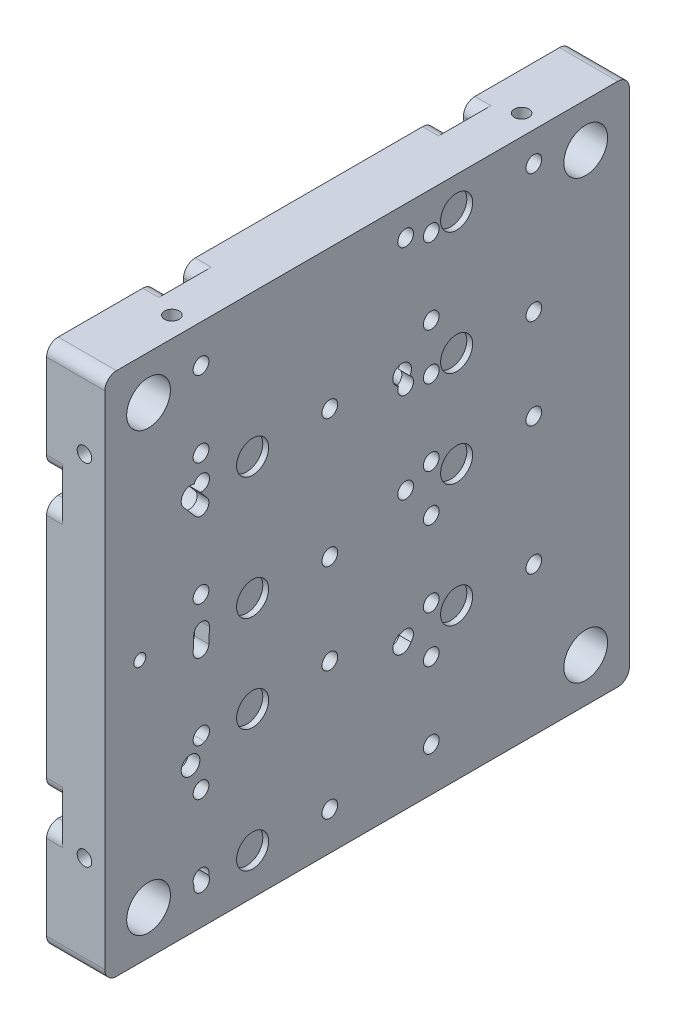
SolidWorks part; units mm, degrees
ref_plane "前视基准面" through (0, 0, 0) normal (0, 0, 1) x (1, 0, 0)
ref_plane "上视基准面" through (0, 0, 0) normal (0, 1, 0) x (1, 0, 0)
ref_plane "右视基准面" through (0, 0, 0) normal (1, 0, 0) x (0, 0, -1)
sketch "草图1" plane through (0, 0, 0) normal (1, 0, 0) x (0, 0, -1)
  line L1 (-45, 45) -> (45, 45)
  line L2 (-45, 45) -> (-45, -45)
  line L3 (-45, -45) -> (45, -45)
  line L4 (45, 45) -> (45, -45)
  line L5 (-45, 45) -> (45, -45) construction
  line L6 (-45, -45) -> (45, 45) construction
  point P0 (0, 0)
  dimension "D1" = 90
  dimension "D2" = 90
extrude "凸台-拉伸1" add sketch "草图1" along normal blind 10
sketch "草图2" plane through (0, 0, 0) normal (-1, 0, 0) x (0, 0, 1)
  line L0 (-25, -25) -> (-25, 25) construction
  line L1 (-26.5, -26.5) -> (26.5, -26.5)
  line L2 (-26.5, -26.5) -> (-26.5, 26.5)
  line L3 (-21.5, 26.5) -> (21.5, 26.5)
  line L4 (26.5, -21.5) -> (26.5, 21.5)
  line L5 (25, -25) -> (-25, -25) construction
  line L6 (-25, 25) -> (25, 25) construction
  line L7 (25, 25) -> (25, -25) construction
  line L8 (45, 45) -> (45, -45) construction
  line L9 (26.5, -26.5) -> (45, -26.5)
  line L10 (-45, 45) -> (45, 45) construction
  line L11 (26.5, -21.5) -> (45, -21.5)
  line L12 (45, -26.5) -> (45, -21.5)
  line L14 (26.5, 26.5) -> (45, 26.5)
  line L15 (-26.5, 26.5) -> (-26.5, 45)
  line L16 (26.5, 21.5) -> (45, 21.5)
  line L17 (45, 26.5) -> (45, 21.5)
  line L18 (-26.5, 45) -> (-21.5, 45)
  line L19 (-21.5, 26.5) -> (-21.5, 45)
  line L22 (26.5, 26.5) -> (26.5, 45)
  line L23 (26.5, 45) -> (21.5, 45)
  line L24 (21.5, 26.5) -> (21.5, 45)
  dimension "D1" = 1.5
  dimension "D2" = 1.5
  dimension "D3" = 1.5
  dimension "D4" = 1.5
  dimension "D5" = 5
  dimension "D6" = 5
  dimension "D7" = 5
  dimension "D8" = 5
extrude "切除-拉伸1" cut sketch "草图2" against normal blind 2.75
hole_wizard "打孔尺寸(%根据)内六角圆柱头螺钉的类型1" positions "草图4" profile "草图5" counterbore size "M3" standard "GB"
sketch "草图4" plane through (10, 0, 0) normal (1, 0, 0) x (0, 0, -1)
  point P0 (-37.5, 37.5)
  point P2 (37.5, 37.5)
  point P4 (-37.5, -37.5)
  point P6 (37.5, -37.5)
sketch "草图5" plane through (10, 37.5, 37.5) normal (0, 1, 0) x (0, 0, -1)
  line L0 (0, 0) -> (0, 11.0914)
  line L1 (0, 11.0914) -> (1.65, 10.1)
  line L2 (1.65, 10.1) -> (1.65, 6)
  line L3 (1.65, 6) -> (3.75, 6)
  line L4 (3.75, 6) -> (3.75, 0)
  line L5 (3.75, 0) -> (0, 0)
  line L10 (0, 11.0914) -> (-1.65, 10.1) construction
  line L11 (0, -6.35) -> (0, 107.95) construction
  dimension "孔直径" = 3.3
  dimension "孔深度" = 10.1
  dimension "柱形沉头孔直径" = 7.5
  dimension "柱形沉头孔深度" = 6
  dimension "导头角度" = 118
sketch "草图16" plane through (0, 0, 0) normal (-1, 0, 0) x (0, 0, 1)
  line L0 (-26.5, 45) -> (-26.5, -26.5) construction
  circle A0 centre (-26.5, 24) radius 2.5
  circle A1 centre (-26.5, -24) radius 2.5
  dimension "D1" = 5
extrude "切除-拉伸3" cut sketch "草图16" against normal up to surface (2.75 mm away)
fillet "圆角2" radius 2 13 edges at (1.375, -26.5, 45) (1.375, -21.5, 45) (1.375, 26.5, 45) (1.375, 21.5, 45) (1.375, 21.5, 26.5) (1.375, -21.5, 26.5) (1.375, 45, -26.5) (1.375, 45, -21.5) (1.375, 45, 21.5) (1.375, 45, 26.5) (1.375, 26.5, 26.5) (1.375, 26.5, 21.5) (1.375, 26.5, -21.5)
fillet "圆角1" radius 2 4 edges at (5, -45, 45) (5, 45, 45) (5, 45, -45) (5, -45, -45)
hole_wizard "M3 螺纹孔3" positions "草图19" profile "草图20" tap size "M3" standard "GB"
sketch "草图19" plane through (0, -45, 0) normal (0, -1, 0) x (-1, 0, 0)
  line L2 (-10, -43) -> (-10, 43) construction
  point P0 (-6.5, -30)
  point P2 (-6.5, 30)
  dimension "D1" = 60
  dimension "D2" = 30
  dimension "D3" = 3.5
sketch "草图20" plane through (6.5, -45, 30) normal (1, 0, 0) x (0, 0, -1)
  line L0 (0, 0) -> (0, 5.7511)
  line L1 (0, 5.7511) -> (1.25, 5)
  line L2 (1.25, 5) -> (1.25, 0)
  line L5 (1.25, 0) -> (0, 0)
  line L10 (0, 5.7511) -> (-1.25, 5) construction
  line L11 (0, -6.35) -> (0, 107.95) construction
  dimension "螺纹孔钻头直径" = 2.5
  dimension "螺纹孔钻头深度" = 5
  dimension "导头角度" = 118
hole_wizard "M3 螺纹孔4" positions "草图21" profile "草图22" tap size "M3" standard "GB"
sketch "草图21" plane through (0, 45, 0) normal (0, 1, 0) x (1, 0, 0)
  line L1 (10, 43) -> (10, -43) construction
  point P2 (6.5, -30)
  point P15 (6.5, 30)
  dimension "D1" = 3.5
  dimension "D2" = 3.5
sketch "草图22" plane through (6.5, 45, 30) normal (1, 0, 0) x (0, 0, 1)
  line L0 (0, 0) -> (0, 6.7511)
  line L1 (0, 6.7511) -> (1.25, 6)
  line L2 (1.25, 6) -> (1.25, 0)
  line L5 (1.25, 0) -> (0, 0)
  line L10 (0, 6.7511) -> (-1.25, 6) construction
  line L11 (0, -6.35) -> (0, 107.95) construction
  dimension "螺纹孔钻头直径" = 2.5
  dimension "螺纹孔钻头深度" = 6
  dimension "导头角度" = 118
hole_wizard "打孔尺寸(%根据)内六角圆柱头螺钉的类型0" positions "草图29" profile "草图30" counterbore size "M3" standard "GB"
sketch "草图29" plane through (0, 0, 0) normal (-1, 0, 0) x (0, 0, 1)
  point P0 (30.3, -20)
  point P4 (30.3, 20)
  point P6 (-6, 20)
  point P10 (-6, -20)
sketch "草图30" plane through (0, -20, 30.3) normal (0, 1, 0) x (0, 0, 1)
  line L0 (0, 0) -> (0, 10)
  line L1 (0, 10) -> (1.6, 10)
  line L3 (1.6, 10) -> (1.6, 8)
  line L4 (1.6, 8) -> (3.75, 8)
  line L5 (3.75, 8) -> (3.75, 0)
  line L7 (3.75, 0) -> (0, 0)
  line L11 (0, -6.35) -> (0, 107.95) construction
  dimension "通孔孔直径" = 3.2
  dimension "通孔孔深度" = 10
  dimension "柱形沉头孔直径" = 7.5
  dimension "柱形沉头孔深度" = 8
hole_wizard "打孔尺寸(%根据)内六角圆柱头螺钉的类型0" positions "草图31" profile "草图32" counterbore size "M2.5" standard "GB"
sketch "草图31" plane through (0, 0, 0) normal (-1, 0, 0) x (0, 0, 1)
  point P45 (-28.6, 39.95)
  point P47 (-6.6, 39.95)
  point P49 (-6.6, 17.95)
  point P51 (-28.6, 17.95)
  point P53 (-28.6, 2.45)
  point P55 (-6.6, 2.45)
  point P57 (-28.6, -19.55)
  point P59 (-6.6, -19.55)
  point P61 (6.4, 21.05)
  point P63 (6.4, -0.95)
  point P65 (6.4, -16.45)
  point P67 (6.4, -38.45)
  point P69 (28.4, -38.45)
  point P71 (28.4, -16.45)
  point P73 (28.4, -0.95)
  point P75 (28.4, 21.05)
sketch "草图32" plane through (0, 39.95, -28.6) normal (0, 1, 0) x (0, 0, 1)
  line L0 (0, 0) -> (0, 10)
  line L1 (0, 10) -> (1.35, 10)
  line L3 (1.35, 10) -> (1.35, 7.5)
  line L4 (1.35, 7.5) -> (3.25, 7.5)
  line L5 (3.25, 7.5) -> (3.25, 0)
  line L7 (3.25, 0) -> (0, 0)
  line L11 (0, -6.35) -> (0, 107.95) construction
  dimension "通孔孔直径" = 2.7
  dimension "通孔孔深度" = 10
  dimension "柱形沉头孔直径" = 6.5
  dimension "柱形沉头孔深度" = 7.5
sketch "草图33" plane through (10, 0, 0) normal (1, 0, 0) x (0, 0, -1)
  circle A0 centre (15.35, 39.45) radius 2.75
  circle A1 centre (15.35, 18.45) radius 2.75
  circle A2 centre (15.35, 1.95) radius 2.75
  circle A3 centre (15.35, -19.05) radius 2.75
  circle A4 centre (-19.65, 20.55) radius 2.75
  circle A5 centre (-19.65, -0.45) radius 2.75
  circle A6 centre (-19.65, -16.95) radius 2.75
  circle A7 centre (-19.65, -37.9503) radius 2.75
  dimension "D1" = 5.5
extrude "切除-拉伸7" cut sketch "草图33" against normal blind 1
hole_wizard "M3 螺纹孔5" positions "草图34" profile "草图35" tap size "M3" standard "GB"
sketch "草图34" plane through (0, 0, -45) normal (0, 0, -1) x (-1, 0, 0)
  point P0 (-6.5, -28.1464)
  point P2 (-6.5, 31.8536)
sketch "草图35" plane through (6.5, -28.1464, -45) normal (1, 0, 0) x (0, 1, 0)
  line L0 (0, 0) -> (0, 8.2511)
  line L1 (0, 8.2511) -> (1.25, 7.5)
  line L2 (1.25, 7.5) -> (1.25, 0)
  line L5 (1.25, 0) -> (0, 0)
  line L10 (0, 8.2511) -> (-1.25, 7.5) construction
  line L11 (0, -6.35) -> (0, 107.95) construction
  dimension "螺纹孔钻头直径" = 2.5
  dimension "螺纹孔钻头深度" = 7.5
  dimension "导头角度" = 118
hole_wizard "M3 螺纹孔6" positions "草图36" profile "草图37" tap size "M3" standard "GB"
sketch "草图36" plane through (0, 0, 45) normal (0, 0, 1) x (1, 0, 0)
  line L0 (10, 43) -> (10, -43) construction
  point P0 (6.5, 31.8536)
  point P2 (6.5, -28.1464)
  dimension "D1" = 3.5
  dimension "D2" = 3.5
sketch "草图37" plane through (6.5, 31.8536, 45) normal (1, 0, 0) x (0, -1, 0)
  line L0 (0, 0) -> (0, 8.2511)
  line L1 (0, 8.2511) -> (1.25, 7.5)
  line L2 (1.25, 7.5) -> (1.25, 0)
  line L5 (1.25, 0) -> (0, 0)
  line L10 (0, 8.2511) -> (-1.25, 7.5) construction
  line L11 (0, -6.35) -> (0, 107.95) construction
  dimension "螺纹孔钻头直径" = 2.5
  dimension "螺纹孔钻头深度" = 7.5
  dimension "导头角度" = 118
sketch "草图38" plane through (0, 0, 0) normal (-1, 0, 0) x (0, 0, 1)
  line L1 (26.5, -19.0868) -> (26.5, -19.5)
  line L2 (26.5, -19.0868) -> (26.5, -19.5)
  arc A3 (26.5, -19.0868) -> (26.6402, -19.1823) centre (28.4, -16.45) ccw
  arc A4 (26.5, -19.5) -> (26.5504, -19.9461) centre (28.5, -19.5) ccw
  arc A5 (26.6402, -19.1823) -> (26.5504, -19.9461) centre (30.3, -20) ccw
  arc A6 (26.5, -19.0868) -> (26.6402, -19.1823) centre (28.4, -16.45) ccw
  arc A7 (26.5, -19.5) -> (26.5504, -19.9461) centre (28.5, -19.5) ccw
  arc A8 (26.6402, -19.1823) -> (26.5504, -19.9461) centre (30.3, -20) ccw
  dimension "D1" = 0
extrude "切除-拉伸8" cut sketch "草图38" against normal up to surface (2.75 mm away)
sketch "草图39" plane through (7.5, 0, 0) normal (-1, 0, 0) x (0, 0, 1)
  arc A2 (-9.6401, 19.0989) -> (-3.4201, 17.2785) centre (-6.6, 17.95) ccw
  arc A3 (-9.6401, 19.0989) -> (-3.4201, 17.2785) centre (-6, 20) ccw
  arc A4 (-9.6401, 19.0989) -> (-3.4201, 17.2785) centre (-6.6, 17.95) ccw
  arc A5 (-9.6401, 19.0989) -> (-3.4201, 17.2785) centre (-6, 20) ccw
  arc A6 (30.2106, 23.7489) -> (27.0783, 18.0809) centre (28.4, 21.05) ccw
  arc A7 (30.2106, 23.7489) -> (27.0783, 18.0809) centre (30.3, 20) ccw
  arc A8 (31.6496, -16.5013) -> (26.6402, -19.1823) centre (28.4, -16.45) ccw
  arc A9 (27.5248, -17.4779) -> (26.6402, -19.1823) centre (30.3, -20) ccw
  arc A10 (29.7407, -16.2919) -> (27.5248, -17.4779) centre (28.4, -16.45) ccw
  arc A11 (31.6496, -16.5013) -> (29.7407, -16.2919) centre (30.3, -20) ccw
  arc A12 (31.6496, -16.5013) -> (26.6402, -19.1823) centre (28.4, -16.45) ccw
  arc A13 (27.5248, -17.4779) -> (26.6402, -19.1823) centre (30.3, -20) ccw
  arc A14 (29.7407, -16.2919) -> (27.5248, -17.4779) centre (28.4, -16.45) ccw
  arc A15 (31.6496, -16.5013) -> (29.7407, -16.2919) centre (30.3, -20) ccw
  arc A16 (30.2106, 23.7489) -> (27.0783, 18.0809) centre (28.4, 21.05) ccw
  arc A17 (30.2106, 23.7489) -> (27.0783, 18.0809) centre (30.3, 20) ccw
  dimension "D1" = 0
  dimension "D2" = 0
  dimension "D3" = 0
extrude "切除-拉伸10" cut sketch "草图39" against normal up to surface (0.5 mm away)
hole_wizard "打孔尺寸(%根据)内六角圆柱头螺钉的类型0" positions "草图42" profile "草图41" counterbore size "M2.5" standard "GB"
sketch "草图42" plane through (0, 0, 0) normal (-1, 0, 0) x (0, 0, 1)
  point P0 (-11, -37.5)
  point P2 (-11, -24.5)
  point P4 (28.5, -37.5)
  point P6 (28.5, -24.5)
sketch "草图41" plane through (0, -37.5, -11) normal (0, 1, 0) x (0, 0, 1)
  line L0 (0, 0) -> (0, 10)
  line L1 (0, 10) -> (1.35, 10)
  line L3 (1.35, 10) -> (1.35, 7.5)
  line L4 (1.35, 7.5) -> (3.25, 7.5)
  line L5 (3.25, 7.5) -> (3.25, 0)
  line L7 (3.25, 0) -> (0, 0)
  line L11 (0, -6.35) -> (0, 107.95) construction
  dimension "通孔孔直径" = 2.7
  dimension "通孔孔深度" = 10
  dimension "柱形沉头孔直径" = 6.5
  dimension "柱形沉头孔深度" = 7.5
pattern_linear "阵列(线性)1" count 4 spacing 21 along (0, 1, 0) of "打孔尺寸(%根据)内六角圆柱头螺钉的类型0"
sketch "草图43" plane through (7.5, 0, 0) normal (-1, 0, 0) x (0, 0, 1)
  arc A2 (-6.6104, -16.3) -> (-7.75, -16.5103) centre (-6.6, -19.55) ccw
  arc A3 (-6.6104, -16.3) -> (-9.7229, -20.45) centre (-6, -20) ccw
  arc A4 (-6.6104, -16.3) -> (-7.75, -16.5103) centre (-6.6, -19.55) ccw
  arc A5 (-6.6104, -16.3) -> (-9.7229, -20.45) centre (-6, -20) ccw
  arc A8 (-7.75, -16.5103) -> (-9.85, -19.5397) centre (-11, -16.5) ccw
  arc A9 (-7.75, -16.5103) -> (-9.85, -19.5397) centre (-11, -16.5) ccw
  arc A10 (-9.85, -19.5397) -> (-9.7229, -20.45) centre (-6.6, -19.55) ccw
  arc A11 (-9.85, -19.5397) -> (-9.7229, -20.45) centre (-6.6, -19.55) ccw
  dimension "D1" = 0
extrude "切除-拉伸11" cut sketch "草图43" against normal up to surface (0.5 mm away)
sketch "草图44" plane through (7.5, 0, 0) normal (-1, 0, 0) x (0, 0, 1)
  arc A2 (-9.3393, -21.7063) -> (-8.0474, -23.1417) centre (-11, -24.5) ccw
  arc A3 (31.7497, -16.5416) -> (29.9032, -13.5685) centre (28.5, -16.5) ccw
  arc A4 (26.9337, -21.6524) -> (31.5981, -23.5181) centre (28.5, -24.5) ccw
  arc A5 (31.1704, 23.6476) -> (26.0822, 23.3282) centre (28.5, 25.5) ccw
  arc A6 (27.9473, 24.2683) -> (26.0822, 23.3282) centre (28.4, 21.05) ccw
  arc A7 (28.9968, 24.2447) -> (27.9473, 24.2683) centre (28.5, 25.5) ccw
  arc A8 (30.2106, 23.7489) -> (28.9968, 24.2447) centre (28.4, 21.05) ccw
  arc A9 (31.1704, 23.6476) -> (30.2106, 23.7489) centre (30.3, 20) ccw
  arc A10 (31.1704, 23.6476) -> (26.0822, 23.3282) centre (28.5, 25.5) ccw
  arc A11 (27.9473, 24.2683) -> (26.0822, 23.3282) centre (28.4, 21.05) ccw
  arc A12 (28.9968, 24.2447) -> (27.9473, 24.2683) centre (28.5, 25.5) ccw
  arc A13 (30.2106, 23.7489) -> (28.9968, 24.2447) centre (28.4, 21.05) ccw
  arc A14 (31.1704, 23.6476) -> (30.2106, 23.7489) centre (30.3, 20) ccw
  arc A15 (29.5713, -23.6785) -> (31.5981, -23.5181) centre (30.3, -20) ccw
  arc A16 (28.2908, -23.1663) -> (29.5713, -23.6785) centre (28.5, -24.5) ccw
  arc A17 (26.9337, -21.6524) -> (28.2908, -23.1663) centre (30.3, -20) ccw
  arc A18 (26.9337, -21.6524) -> (31.5981, -23.5181) centre (28.5, -24.5) ccw
  arc A19 (29.5713, -23.6785) -> (31.5981, -23.5181) centre (30.3, -20) ccw
  arc A20 (28.2908, -23.1663) -> (29.5713, -23.6785) centre (28.5, -24.5) ccw
  arc A21 (26.9337, -21.6524) -> (28.2908, -23.1663) centre (30.3, -20) ccw
  arc A22 (31.6496, -16.5013) -> (29.9032, -13.5685) centre (28.4, -16.45) ccw
  arc A23 (31.7497, -16.5416) -> (31.6496, -16.5013) centre (30.3, -20) ccw
  arc A24 (31.7497, -16.5416) -> (29.9032, -13.5685) centre (28.5, -16.5) ccw
  arc A25 (31.6496, -16.5013) -> (29.9032, -13.5685) centre (28.4, -16.45) ccw
  arc A26 (31.7497, -16.5416) -> (31.6496, -16.5013) centre (30.3, -20) ccw
  arc A27 (-9.3393, -21.7063) -> (-8.0474, -23.1417) centre (-6, -20) ccw
  arc A28 (-9.3393, -21.7063) -> (-8.0474, -23.1417) centre (-11, -24.5) ccw
  arc A29 (-9.841, 18.1922) -> (-9.7248, 17.0568) centre (-11, 17.5) ccw
  arc A30 (-9.6401, 19.0989) -> (-9.841, 18.1922) centre (-6.6, 17.95) ccw
  arc A31 (-9.7183, 20.4866) -> (-9.6401, 19.0989) centre (-6, 20) ccw
  arc A32 (-9.7183, 20.4866) -> (-8.5577, 15.3558) centre (-11, 17.5) ccw
  arc A33 (-9.7248, 17.0568) -> (-8.5577, 15.3558) centre (-6.6, 17.95) ccw
  arc A34 (-9.841, 18.1922) -> (-9.7248, 17.0568) centre (-11, 17.5) ccw
  arc A35 (-9.6401, 19.0989) -> (-9.841, 18.1922) centre (-6.6, 17.95) ccw
  arc A36 (-9.7183, 20.4866) -> (-9.6401, 19.0989) centre (-6, 20) ccw
  arc A37 (-9.7183, 20.4866) -> (-8.5577, 15.3558) centre (-11, 17.5) ccw
  arc A38 (-9.7248, 17.0568) -> (-8.5577, 15.3558) centre (-6.6, 17.95) ccw
  arc A39 (-9.3393, -21.7063) -> (-8.0474, -23.1417) centre (-6, -20) ccw
  dimension "D1" = 0
  dimension "D2" = 0
  dimension "D3" = 0
  dimension "D4" = 0
  dimension "D5" = 0
extrude "切除-拉伸12" cut sketch "草图44" against normal up to surface (0.5 mm away)
hole_wizard "M2.5 螺纹孔1" positions "草图45" profile "草图46" tap size "M2.5" standard "GB"
sketch "草图45" plane through (10, 0, 0) normal (1, 0, 0) x (0, 0, -1)
  line L0 (-45, 43) -> (-45, -43) construction
  point P0 (-39, 0)
  dimension "D1" = 6
sketch "草图46" plane through (10, 0, 39) normal (0, 1, 0) x (0, 0, -1)
  line L0 (0, 0) -> (0, 6.6159)
  line L1 (0, 6.6159) -> (1.025, 6)
  line L2 (1.025, 6) -> (1.025, 0)
  line L5 (1.025, 0) -> (0, 0)
  line L10 (0, 6.6159) -> (-1.025, 6) construction
  line L11 (0, -6.35) -> (0, 107.95) construction
  dimension "螺纹孔钻头直径" = 2.05
  dimension "螺纹孔钻头深度" = 6
  dimension "导头角度" = 118
sketch "草图47" plane through (0, 0, 0) normal (-1, 0, 0) x (0, 0, 1)
  line L1 (26.5, 1.9383) -> (26.5, 1.6868)
  line L2 (26.5, 1.9383) -> (26.5, 1.6868)
  arc A2 (26.5, 1.9383) -> (26.6799, 1.8075) centre (28.5, 4.5) ccw
  arc A3 (26.6799, 1.8075) -> (26.5, 1.6868) centre (28.4, -0.95) ccw
  arc A4 (26.5, 1.9383) -> (26.6799, 1.8075) centre (28.5, 4.5) ccw
  arc A5 (26.6799, 1.8075) -> (26.5, 1.6868) centre (28.4, -0.95) ccw
  dimension "D1" = 0
extrude "切除-拉伸13" cut sketch "草图47" against normal up to surface (2.75 mm away)
sketch "草图48" plane through (7.5, 0, 0) normal (-1, 0, 0) x (0, 0, 1)
  arc A5 (27.2052, 17.8822) -> (29.2732, 16.3933) centre (28.5, 17.5) ccw
  arc A6 (27.0783, 18.0809) -> (27.2052, 17.8822) centre (30.3, 20) ccw
  arc A7 (25.7291, 19.1984) -> (27.0783, 18.0809) centre (28.4, 21.05) ccw
  arc A8 (25.7291, 19.1984) -> (31.5848, 16.477) centre (28.5, 17.5) ccw
  arc A9 (29.2732, 16.3933) -> (31.5848, 16.477) centre (30.3, 20) ccw
  arc A10 (27.2052, 17.8822) -> (29.2732, 16.3933) centre (28.5, 17.5) ccw
  arc A11 (27.0783, 18.0809) -> (27.2052, 17.8822) centre (30.3, 20) ccw
  arc A12 (25.7291, 19.1984) -> (27.0783, 18.0809) centre (28.4, 21.05) ccw
  arc A13 (25.7291, 19.1984) -> (31.5848, 16.477) centre (28.5, 17.5) ccw
  arc A14 (29.2732, 16.3933) -> (31.5848, 16.477) centre (30.3, 20) ccw
  dimension "D1" = 0
extrude "切除-拉伸14" cut sketch "草图48" against normal up to surface (0.5 mm away)
sketch "草图49" plane through (8, 0, 0) normal (-1, 0, 0) x (0, 0, 1)
  line L0 (27.4721, 18.3751) -> (29.524, 20.7854)
  line L1 (29.524, 20.7854) -> (31.6185, 19.0805)
  line L2 (31.6185, 19.0805) -> (29.5279, 16.6249)
  line L3 (27.4721, 18.3751) -> (29.5279, 16.6249)
  circle A0 centre (28.5, 17.5) radius 1.35 construction
  arc A1 (28.7215, 19.7388) -> (29.6812, 21.4755) centre (30.3, 20) ccw construction
extrude "切除-拉伸16" cut sketch "草图49" against normal blind 10
sketch "草图50" plane through (7.5, 0, 0) normal (-1, 0, 0) x (0, 0, 1)
  line L0 (29.849, -3.4471) -> (29.749, -0.8971)
  line L1 (29.749, -0.8971) -> (27.051, -1.0029)
  line L2 (27.051, -1.0029) -> (27.151, -3.5529)
  line L3 (27.151, -3.5529) -> (29.849, -3.4471)
  arc A0 (28.0095, -2.2423) -> (28.8905, -2.2077) centre (28.5, -3.5) ccw construction
  arc A1 (28.8905, -2.2077) -> (28.0095, -2.2423) centre (28.4, -0.95) ccw construction
  point P10 (29.8473, -3.4039)
  point P11 (27.15, -3.5)
  point P12 (29.85, -3.5)
  point P13 (29.75, -0.95)
  point P14 (27.05, -0.95)
extrude "切除-拉伸17" cut sketch "草图50" against normal blind 10
